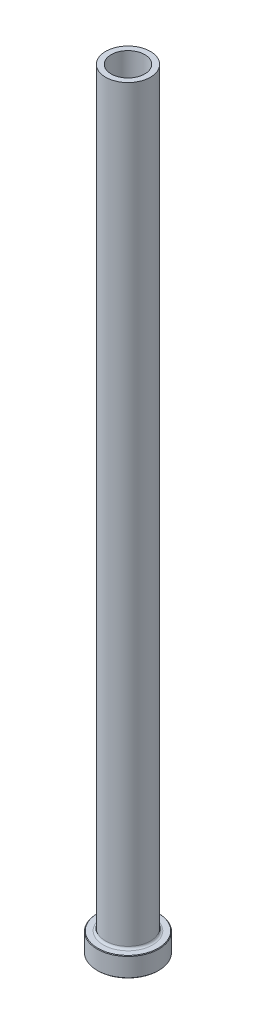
SolidWorks part; units mm, degrees
ref_plane "Front Plane" through (0, 0, 0) normal (0, 0, 1) x (1, 0, 0)
ref_plane "Top Plane" through (0, 0, 0) normal (0, 1, 0) x (1, 0, 0)
ref_plane "Right Plane" through (0, 0, 0) normal (1, 0, 0) x (0, 0, -1)
sketch "Sketch1" plane through (0, 0, 0) normal (0, 0, 1) x (1, 0, 0)
  line L0 (-6, 275) -> (-8, 275)
  line L1 (-8, 275) -> (-8, 7)
  line L2 (-8, 7) -> (-11, 7)
  line L3 (-11, 7) -> (-11, 0)
  line L4 (12.1, 0) -> (-12.1, 0) construction
  line L5 (-11, 0) -> (-6.25, 0)
  line L6 (-6, 220) -> (-6, 275)
  line L7 (0, 92.1877) -> (0, -15.5353) construction
  line L8 (0, -12.1) -> (0, 12.1) construction
  line L9 (-6, 220) -> (-6.25, 208)
  line L10 (-6.25, 208) -> (-6.25, 0)
  dimension "D1" = 0.25
  dimension "ID" = 12
  dimension "OD" = 16
  dimension "L" = 275
  dimension "H" = 22
  dimension "T" = 7
  dimension "N" = 55
  dimension "D2" = 12
revolve "Revolve1" add sketch "Sketch1" angle 360 about L7
fillet "Fillet1" radius 0.8 1 edges at (0, 7, 8)
chamfer "Chamfer1" distance 0.2 angle 45 2 edges at (0, 7, 11) (0, 0, 11)
chamfer "Chamfer3" distance 0.5 angle 45 1 edges at (0, 0, 6.25)
